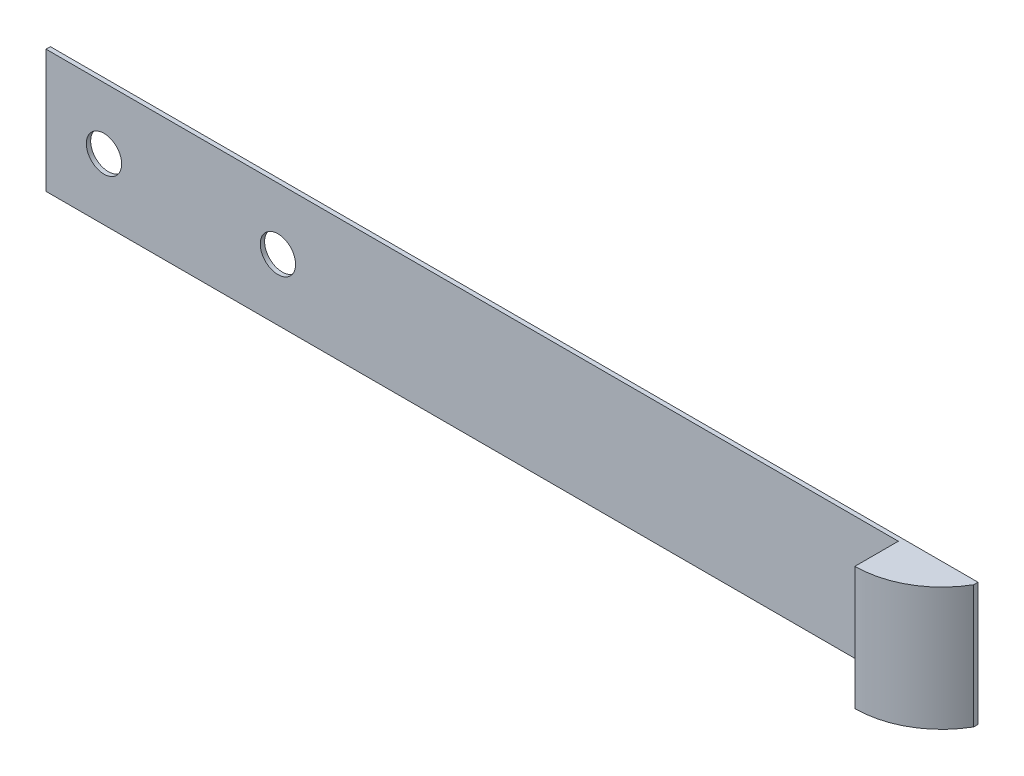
SolidWorks part; units mm, degrees
ref_plane "Front Plane" through (0, 0, 0) normal (0, 0, 1) x (1, 0, 0)
ref_plane "Top Plane" through (0, 0, 0) normal (0, 1, 0) x (1, 0, 0)
ref_plane "Right Plane" through (0, 0, 0) normal (1, 0, 0) x (0, 0, -1)
sketch "Sketch1" plane through (0, 0, 0) normal (0, 0, 1) x (1, 0, 0)
  line L0 (-16, 0) -> (48, 0) construction
  line L1 (-16, 4.25) -> (48, 4.25)
  line L2 (-16, 4.25) -> (-16, -4.25)
  line L3 (-16, -4.25) -> (48, -4.25)
  line L4 (48, 4.25) -> (48, -4.25)
  dimension "D1" = 64
  dimension "D2" = 8.5
  dimension "D3" = 16
extrude "Extrude1" add sketch "Sketch1" along normal blind 0.3
sketch "Sketch3" plane through (0, -4.25, 0) normal (0, -1, 0) x (1, 0, 0)
  line L0 (-16, 0.3) -> (48, 0.3) construction
  line L1 (42.8038, 3.3) -> (42.8038, 0.3)
  line L3 (42.8038, 0.3) -> (48, 0.3)
  arc A0 (42.8038, 3.3) -> (48, 0.3) centre (42.8038, -2.7) cw
  dimension "D1" = 3
  dimension "D3" = 6
extrude "Extrude2" add sketch "Sketch3" against normal up to surface (8.5 mm away)
hole_wizard "#2 Clearance Hole1" positions "Sketch6" profile "Sketch5" hole size "#2" standard "Ansi Inch"
sketch "Sketch6" plane through (0, 0, 0) normal (0, 0, -1) x (-1, 0, 0)
  line L0 (16, 4.25) -> (16, -4.25) construction
  line L1 (0, 0) -> (16, 0) construction
  point P0 (12, 0)
  point P3 (12, 0)
  point P14 (0, 0)
  dimension "D1" = 12
  dimension "D2" = 4
sketch "Sketch5" plane through (-12, 0, 0) normal (1, 0, 0) x (0, 1, 0)
  line L0 (0, 0) -> (0, 12.7326)
  line L1 (0, 12.7326) -> (1.2192, 12)
  line L2 (1.2192, 12) -> (1.2192, 0)
  line L5 (1.2192, 0) -> (0, 0)
  line L10 (0, 12.7326) -> (-1.2192, 12) construction
  line L11 (0, -6.35) -> (0, 107.95) construction
  dimension "Hole Dia." = 2.4384
  dimension "Hole Depth" = 12
  dimension "Drill Angle" = 118
